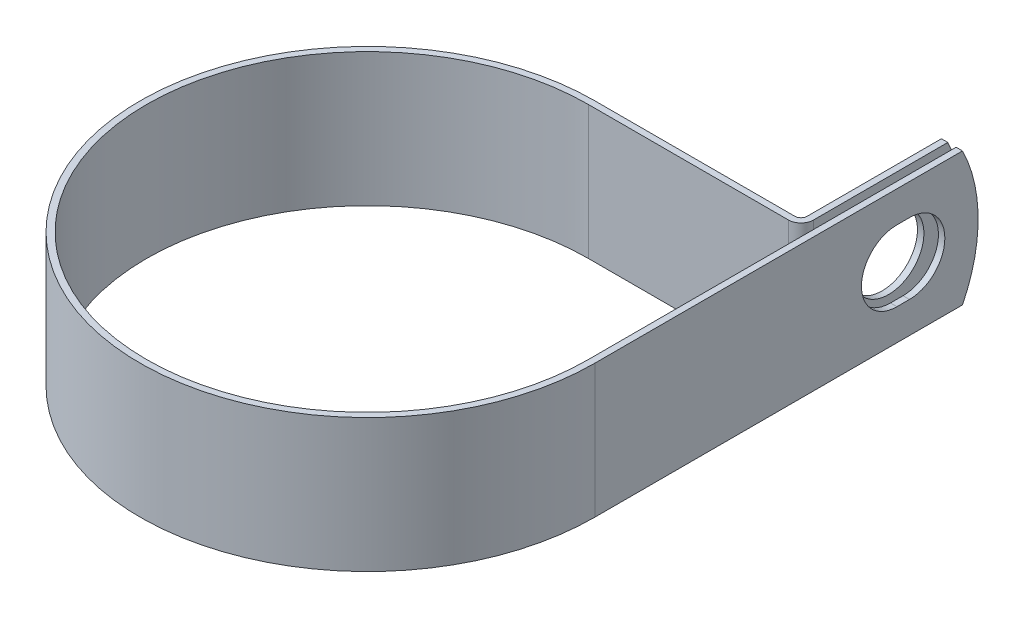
SolidWorks part; units mm, degrees
ref_plane "Front Plane" through (0, 0, 0) normal (0, 0, 1) x (1, 0, 0)
ref_plane "Top Plane" through (0, 0, 0) normal (0, 1, 0) x (1, 0, 0)
ref_plane "Right Plane" through (0, 0, 0) normal (1, 0, 0) x (0, 0, -1)
sketch "Sketch1" plane through (0, 0, 0) normal (0, 1, 0) x (1, 0, 0)
  line L0 (0, 42.0624) -> (38.1102, 42.0624)
  line L1 (42.0624, 0) -> (42.0624, 42.0624)
  line L2 (40.4876, 72.9996) -> (40.4876, 44.4398)
  line L5 (42.0624, 42.0624) -> (42.0624, 72.9996)
  arc A0 (0, 42.0624) -> (42.0624, 0) centre (0, 0) ccw
  arc A3 (38.1102, 42.0624) -> (40.4876, 44.4398) centre (38.1102, 44.4398) ccw
extrude "Extrude-Thin1" add sketch "Sketch1" along normal mid plane 25.4 thin
sketch "Sketch2" plane through (39.2684, 0, 0) normal (-1, 0, 0) x (0, 0, 1)
  line L0 (-72.9996, 12.7) -> (-72.9996, -12.7) construction
  line L7 (0, 12.7) -> (0, -12.7) construction
  circle A0 centre (-58.7248, 0) radius 6.7437
  point P2 (-72.9996, 0)
extrude "Cut-Extrude1" cut sketch "Sketch2" against normal up to surface (1.2192 mm away)
sketch "Sketch3" plane through (43.2816, 0, 0) normal (1, 0, 0) x (0, 0, -1)
  line L0 (57.531, 0) -> (59.9186, 0) construction
  line L1 (57.531, 6.7437) -> (59.9186, 6.7437)
  line L2 (57.531, -6.7437) -> (59.9186, -6.7437)
  line L3 (72.9996, 12.7) -> (72.9996, -12.7) construction
  arc A0 (57.531, 6.7437) -> (57.531, -6.7437) centre (57.531, 0) ccw
  arc A1 (59.9186, -6.7437) -> (59.9186, 6.7437) centre (59.9186, 0) ccw
  point P3 (58.7248, 0)
  point P8 (72.9996, 0)
  point P11 (50.7873, 0)
  point P12 (66.6623, 0)
extrude "Cut-Extrude2" cut sketch "Sketch3" against normal up to surface (1.2192 mm away)
sketch "Sketch4" plane through (39.2684, 0, 0) normal (-1, 0, 0) x (0, 0, 1)
  line L0 (-72.9996, 12.7) -> (-72.9996, -12.7)
  line L1 (-72.9996, 12.7) -> (-70.0223, 12.7)
  line L2 (-72.9996, 12.7) -> (-44.4398, 12.7) construction
  line L3 (-72.9996, -12.7) -> (-70.0223, -12.7)
  line L4 (-72.9996, -12.7) -> (-44.4398, -12.7) construction
  arc A0 (-70.0223, 12.7) -> (-70.0223, -12.7) centre (-44.4246, 0) ccw
extrude "Cut-Extrude3" cut sketch "Sketch4" against normal through all contours A0 M4 M5 | A0 L0 M2
equation "\"D1@Sketch3\" = \"D2@Sketch2\""
equation "\"D7@Sketch1\" = \"D3@Sketch2\" + \"D1@Sketch3\""
equation "\"D1@Sketch4\" = ( \"D1@Extrude-Thin1\" + .125 ) * 2"
equation "\"D2@Sketch1\"=1.95*\"D5@Extrude-Thin1\""
equation "\"D2@Sketch3\" = \"D1@Sketch2\""
